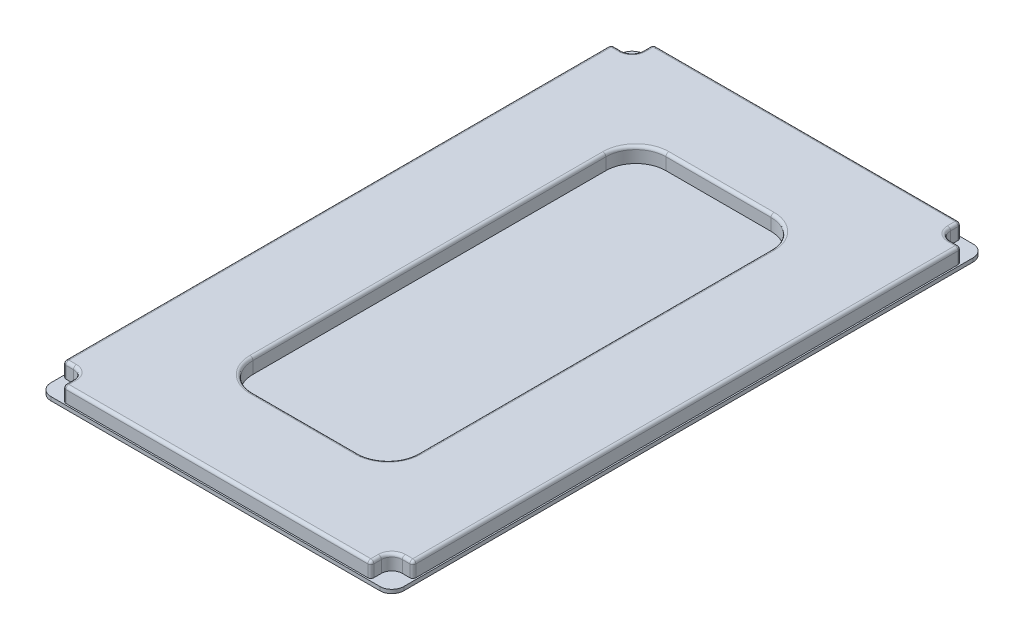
SolidWorks part; units mm, degrees
ref_plane "Front" through (0, 0, 0) normal (0, 0, 1) x (1, 0, 0)
ref_plane "Top" through (0, 0, 0) normal (0, 1, 0) x (1, 0, 0)
ref_plane "Right" through (0, 0, 0) normal (1, 0, 0) x (0, 0, -1)
sketch "Sketch1" plane through (0, 0, 0) normal (0, 1, 0) x (1, 0, 0)
  line L1 (2.54, 0) -> (72.0725, 0)
  line L2 (0, 2.54) -> (0, 122.8725)
  line L3 (2.54, 125.4125) -> (72.0725, 125.4125)
  line L4 (74.6125, 2.54) -> (74.6125, 122.8725)
  arc A0 (0, 122.8725) -> (2.54, 125.4125) centre (2.54, 122.8725) cw
  arc A1 (2.54, 0) -> (0, 2.54) centre (2.54, 2.54) cw
  arc A2 (72.0725, 0) -> (74.6125, 2.54) centre (72.0725, 2.54) ccw
  arc A3 (72.0725, 125.4125) -> (74.6125, 122.8725) centre (72.0725, 122.8725) cw
  point P8 (0, 0)
  point P11 (74.6125, 0)
  point P14 (74.6125, 125.4125)
  dimension "D3" = 2.54
  dimension "D1" = 74.6125
  dimension "D2" = 125.4125
sheet metal parameters "Sheet-Metal1" thickness 0.7937 parameters "D1"=0.7366
base flange "Base-Flange1" sketch "Sketch1" thickness 0.7937 reverse thickness direction yes parameters "D1"=0.7366
sketch "Sketch3" plane through (0, 0.7937, 0) normal (0, 1, 0) x (-1, 0, 0)
  line L0 (0, -62.7063) -> (-74.6125, -62.7063) construction
  line L1 (-37.3062, 0) -> (-37.3062, -125.4125) construction
  line L3 (-26.1938, -19.05) -> (-48.4187, -19.05)
  line L4 (0, -122.8725) -> (0, -2.54)
  line L5 (-2.54, 0) -> (-72.0725, 0)
  line L6 (-74.6125, -2.54) -> (-74.6125, -122.8725)
  line L7 (-72.0725, -125.4125) -> (-2.54, -125.4125)
  line L8 (0, -122.8725) -> (0, -2.54) construction
  line L9 (-2.54, 0) -> (-72.0725, 0) construction
  line L10 (-74.6125, -2.54) -> (-74.6125, -122.8725) construction
  line L11 (-72.0725, -125.4125) -> (-2.54, -125.4125) construction
  line L12 (-19.8438, -25.4) -> (-19.8438, -100.0125)
  line L13 (-26.1937, -106.3625) -> (-48.4187, -106.3625)
  line L14 (-54.7687, -25.4) -> (-54.7687, -100.0125)
  line L18 (-69.85, -125.095) -> (-4.7625, -125.095)
  line L19 (-74.295, -4.7625) -> (-74.295, -120.65)
  line L20 (-0.3175, -120.65) -> (-0.3175, -4.7625)
  line L21 (-4.7625, -0.3175) -> (-69.85, -0.3175)
  line L22 (-2.54, -120.65) -> (-0.3175, -120.65)
  line L23 (-4.7625, -122.8725) -> (-4.7625, -125.095)
  line L24 (-2.54, -4.7625) -> (-0.3175, -4.7625)
  line L25 (-4.7625, -2.54) -> (-4.7625, -0.3175)
  line L26 (-72.0725, -4.7625) -> (-74.295, -4.7625)
  line L27 (-69.85, -2.54) -> (-69.85, -0.3175)
  line L28 (-72.0725, -120.65) -> (-74.295, -120.65)
  line L29 (-69.85, -122.8725) -> (-69.85, -125.095)
  arc A0 (-19.8438, -100.0125) -> (-26.1937, -106.3625) centre (-26.1937, -100.0125) cw
  arc A1 (-26.1938, -19.05) -> (-19.8438, -25.4) centre (-26.1938, -25.4) cw
  arc A2 (-48.4187, -19.05) -> (-54.7687, -25.4) centre (-48.4187, -25.4) ccw
  arc A3 (-48.4187, -106.3625) -> (-54.7687, -100.0125) centre (-48.4187, -100.0125) cw
  arc A4 (-2.54, -125.4125) -> (0, -122.8725) centre (-2.54, -122.8725) ccw
  arc A5 (0, -2.54) -> (-2.54, 0) centre (-2.54, -2.54) ccw
  arc A6 (-72.0725, 0) -> (-74.6125, -2.54) centre (-72.0725, -2.54) ccw
  arc A7 (-74.6125, -122.8725) -> (-72.0725, -125.4125) centre (-72.0725, -122.8725) ccw
  arc A8 (-2.54, -125.4125) -> (0, -122.8725) centre (-2.54, -122.8725) ccw construction
  arc A9 (0, -2.54) -> (-2.54, 0) centre (-2.54, -2.54) ccw construction
  arc A10 (-72.0725, 0) -> (-74.6125, -2.54) centre (-72.0725, -2.54) ccw construction
  arc A11 (-74.6125, -122.8725) -> (-72.0725, -125.4125) centre (-72.0725, -122.8725) ccw construction
  arc A16 (-2.54, -120.65) -> (-4.7625, -122.8725) centre (-2.54, -122.8725) ccw
  arc A17 (-2.54, -4.7625) -> (-4.7625, -2.54) centre (-2.54, -2.54) cw
  arc A18 (-72.0725, -4.7625) -> (-69.85, -2.54) centre (-72.0725, -2.54) ccw
  arc A19 (-72.0725, -120.65) -> (-69.85, -122.8725) centre (-72.0725, -122.8725) cw
  point P20 (-37.3062, -106.3625)
  point P21 (-54.7687, -62.7063)
  point P26 (-19.8438, -19.05)
  point P29 (-54.7687, -19.05)
  point P32 (-54.7687, -106.3625)
  dimension "D4" = 6.35
  dimension "D5" = 6.35
  dimension "D7" = 2.2225
  dimension "D2" = 34.925
  dimension "D3" = 87.3125
  dimension "D1" = 0
  dimension "D6" = 0.3175
extrude "Extrude1" add sketch "Sketch3" along normal blind 3.175 separate body
fillet "Fillet1" radius 0.635 8 edges at (0.3175, 2.3813, -120.65) (4.7625, 2.3813, -125.095) (0.3175, 2.3813, -4.7625) (4.7625, 2.3813, -0.3175) (69.85, 2.3813, -0.3175) (74.295, 2.3813, -4.7625) (74.295, 2.3813, -120.65) (69.85, 2.3813, -125.095)
fillet "Fillet2" radius 0.635 32 edges at (21.7036, 3.9688, -20.9099) (37.3062, 3.9688, -19.05) (52.9089, 3.9688, -20.9099) (54.7687, 3.9688, -62.7063) (52.9089, 3.9688, -104.5026) (37.3062, 3.9688, -106.3625) (21.7036, 3.9688, -104.5026) (19.8438, 3.9688, -62.7063) (0.5035, 3.9688, -120.464) (1.7462, 3.9688, -120.65) (4.1115, 3.9688, -121.301) (4.7625, 3.9688, -123.6663) (4.9485, 3.9688, -124.909) (37.3062, 3.9688, -125.095) (69.664, 3.9688, -124.909) (69.85, 3.9688, -123.6663) (70.501, 3.9688, -121.301) (72.8662, 3.9688, -120.65) (74.109, 3.9688, -120.464) (74.295, 3.9688, -62.7063) (74.109, 3.9688, -4.9485) (72.8662, 3.9688, -4.7625) (70.501, 3.9688, -4.1115) (69.85, 3.9688, -1.7462) (69.664, 3.9688, -0.5035) (37.3062, 3.9688, -0.3175) (4.9485, 3.9688, -0.5035) (4.7625, 3.9688, -1.7462) (4.1115, 3.9688, -4.1115) (1.7462, 3.9688, -4.7625) (0.5035, 3.9688, -4.9485) (0.3175, 3.9688, -62.7063)
flat pattern "Flat-Pattern1"
sketch "Bend-Lines1" plane through (0, 0, 0) normal (0, 1, 0) x (-1, 0, 0)
